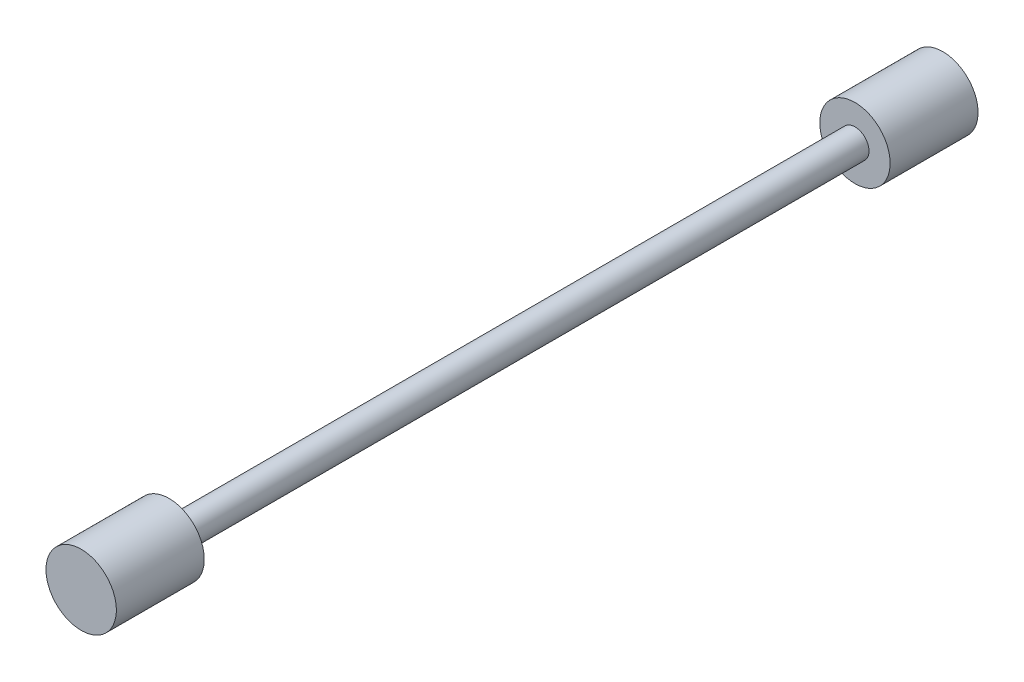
SolidWorks part; units mm, degrees
ref_plane "前视基准面" through (0, 0, 0) normal (0, 0, 1) x (1, 0, 0)
ref_plane "上视基准面" through (0, 0, 0) normal (0, 1, 0) x (1, 0, 0)
ref_plane "右视基准面" through (0, 0, 0) normal (1, 0, 0) x (0, 0, -1)
other "Configuration Table"
sketch "草图1" plane through (0, 0, 0) normal (0, 0, 1) x (1, 0, 0)
  circle A0 centre (0, 0) radius 8
  circle A1 centre (0, 0) radius 6
extrude "凸台-拉伸1" add sketch "草图1" along normal blind 490
ref_point "点1"
ref_plane "基准面1" through (0, 0, 0) normal (0, 1, 0) x (1, 0, 0)
sketch "草图2" plane through (0, 0, 0) normal (0, 1, 0) x (1, 0, 0)
  line L0 (-8, -490) -> (8, -490) construction
  line L1 (0, 0) -> (20, 0)
  line L2 (0, 0) -> (0, -50)
  line L3 (0, -50) -> (20, -50)
  line L4 (20, 0) -> (20, -50)
  line L5 (0, -490) -> (20, -490)
  line L6 (0, -490) -> (0, -440)
  line L7 (0, -440) -> (20, -440)
  line L8 (20, -490) -> (20, -440)
revolve "旋转1" add sketch "草图2" angle 360 about L2
